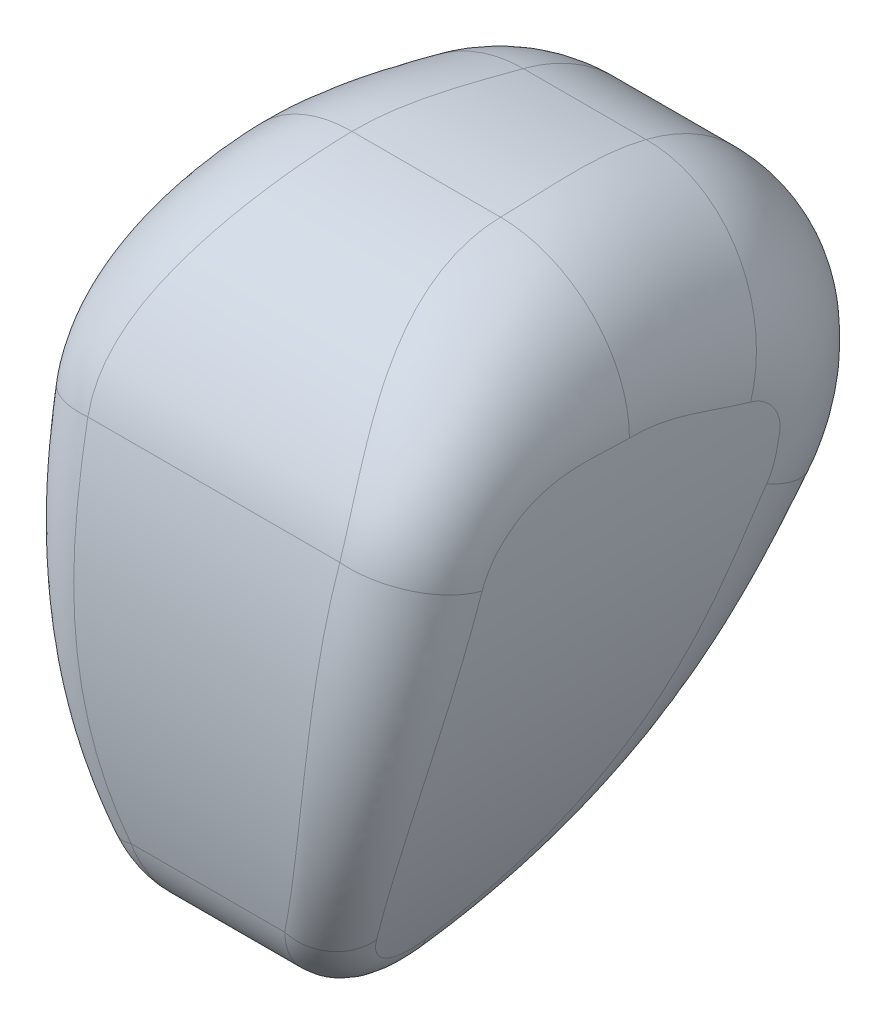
SolidWorks part; units mm, degrees
ref_plane "XY" through (0, 0, 0) normal (0, 0, 1) x (1, 0, 0)
ref_plane "YZ" through (0, 0, 0) normal (0, 1, 0) x (1, 0, 0)
ref_plane "XZ" through (0, 0, 0) normal (1, 0, 0) x (0, 0, -1)
sketch "Sketch9" plane through (0, 0, 0) normal (1, 0, 0) x (0, 0, -1)
  line L0 (-45.1744, 365.7052) -> (6.1106, 476.3141) construction
  line L1 (-45.1744, 365.7052) -> (51.2227, 483.7448) construction
  line L2 (6.1106, 476.3141) -> (51.2227, 483.7448) construction
  line L3 (0, 116.037) -> (0, -116.037) construction
  arc A0 (4.5333, 570.2809) -> (-84.8187, 500.0652) centre (6.1106, 476.3141) ccw
  arc A1 (121.74, 443.3253) -> (71.1881, 562.5345) centre (51.2227, 483.7448) ccw
  arc A2 (-87.3049, 356.243) -> (-34.2264, 323.9361) centre (-45.1744, 365.7052) ccw
  arc A3 (4.5333, 570.2809) -> (71.1881, 562.5345) centre (8.7962, 316.3166) cw
  arc A4 (121.74, 443.3253) -> (-34.2264, 323.9361) centre (-98.6267, 569.6363) cw
  arc A5 (-87.3049, 356.243) -> (-84.8187, 500.0652) centre (210.0869, 423.0346) cw
  dimension "D4" = 93.98
  dimension "D5" = 81.28
  dimension "D6" = 254
  dimension "D7" = 254
  dimension "D8" = 304.8
  dimension "D9" = 43.18
  dimension "D1" = 45.72
  dimension "D2" = 152.4
  dimension "D3" = 121.92
  dimension "D12" = 39.237
extrude "Base-Extrude" add sketch "Sketch9" along normal mid plane 208.28
sketch "Sketch10" plane through (0, 0, 0) normal (1, 0, 0) x (0, 0, -1)
  circle A0 centre (38.554, 379.3379) radius 3.805
extrude "Cut-Extrude1" cut sketch "Sketch10" against normal mid plane 25.4
sketch "Sketch11" plane through (0, 0, 0) normal (0, 0, 1) x (1, 0, 0)
  arc A0 (80.9975, 581.0435) -> (21.292, 293.0524) centre (-367.3168, 523.8022) cw
extrude "Cut-Extrude2" cut sketch "Sketch11" against normal through all and the other way through all
fillet "VarFillet1" radius 20.32
mirror "Mirror2" about plane through (0, 0, 0) normal (1, 0, 0)
